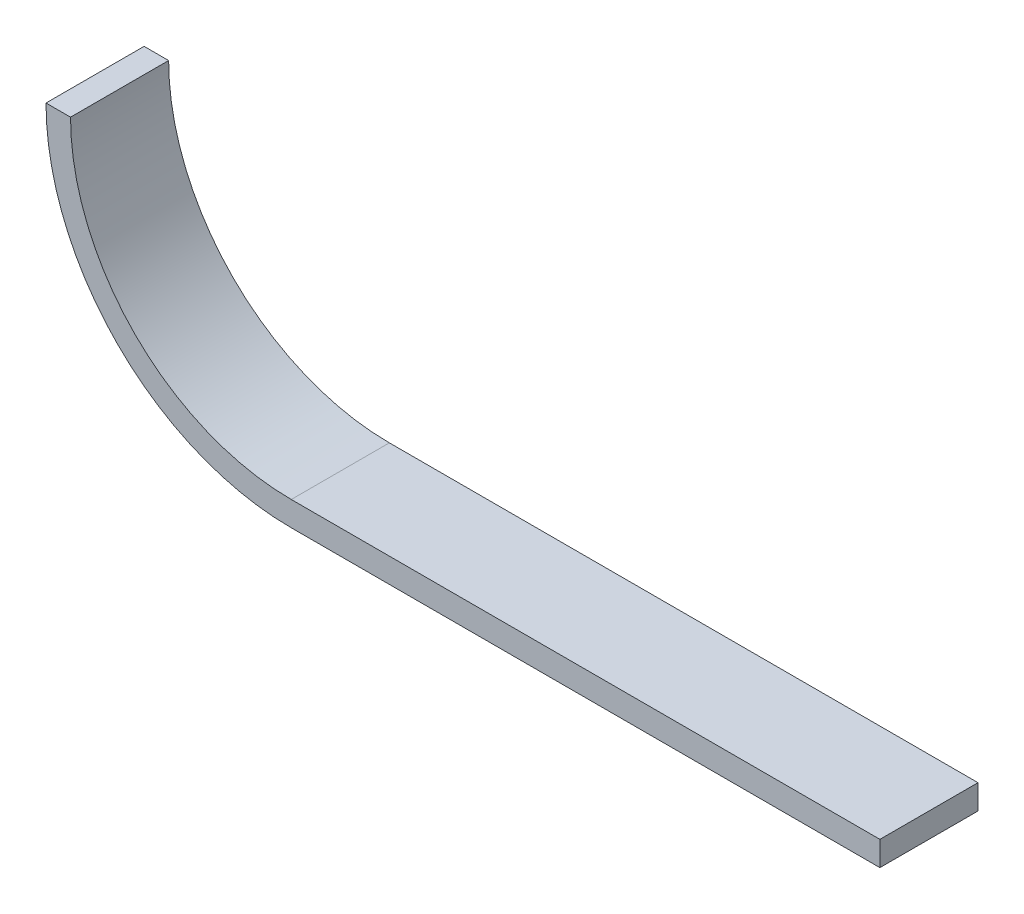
SolidWorks part; units mm, degrees
ref_plane "Front" through (0, 0, 0) normal (0, 0, 1) x (1, 0, 0)
ref_plane "Top" through (0, 0, 0) normal (0, 1, 0) x (1, 0, 0)
ref_plane "Right" through (0, 0, 0) normal (1, 0, 0) x (0, 0, -1)
sketch "Sketch1" plane through (0, 0, 0) normal (0, 0, 1) x (1, 0, 0)
  line L0 (-66.675, 31.75) -> (-69.85, 31.75)
  line L1 (0, 46.7174) -> (0, -24.5349) construction
  line L2 (-38.1, 3.175) -> (38.1, 3.175)
  line L3 (-38.1, 0) -> (38.1, 0)
  line L4 (38.1, 3.175) -> (38.1, 0)
  arc A2 (-38.1, 3.175) -> (-66.675, 31.75) centre (-38.1, 31.75) cw
  arc A3 (-38.1, 0) -> (-69.85, 31.75) centre (-38.1, 31.75) cw
  dimension "D1" = 3.175
  dimension "D2" = 76.2
  dimension "D3" = 31.75
extrude "Extrude1" add sketch "Sketch1" along normal blind 12.7
sketch3d "3DSketch3"
  point P0 (-60.5506, 9.2964, 6.35)
  point P1 (-38.1, 0, 6.35)
  point P2 (0, 0, 6.35)
ref_plane "Plane1" through (0, -15, 0) normal (0, -1, 0) x (1, 0, 0)
sketch "Sketch2" plane through (0, -15, 0) normal (0, -1, 0) x (1, 0, 0)
  line L0 (-69.85, 6.35) -> (38.1, 6.35)
  line L1 (-69.85, 12.7) -> (-69.85, 0) construction
  line L2 (38.1, 12.7) -> (38.1, 0) construction
sketch "Sketch3" plane through (0, -15, 0) normal (0, -1, 0) x (1, 0, 0)
  line L0 (-60.5506, 6.35) -> (-60.5506, 12.7)
  line L1 (-38.1, 12.7) -> (-69.85, 12.7) construction
  line L2 (-60.5506, 6.35) -> (-60.5506, 0)
  line L3 (-69.85, 0) -> (-38.1, 0) construction
sketch "Sketch5" plane through (0, -15, 0) normal (0, -1, 0) x (1, 0, 0)
  line L0 (0, 12.7) -> (0, 0)
  line L1 (-38.1, 12.7) -> (38.1, 12.7) construction
